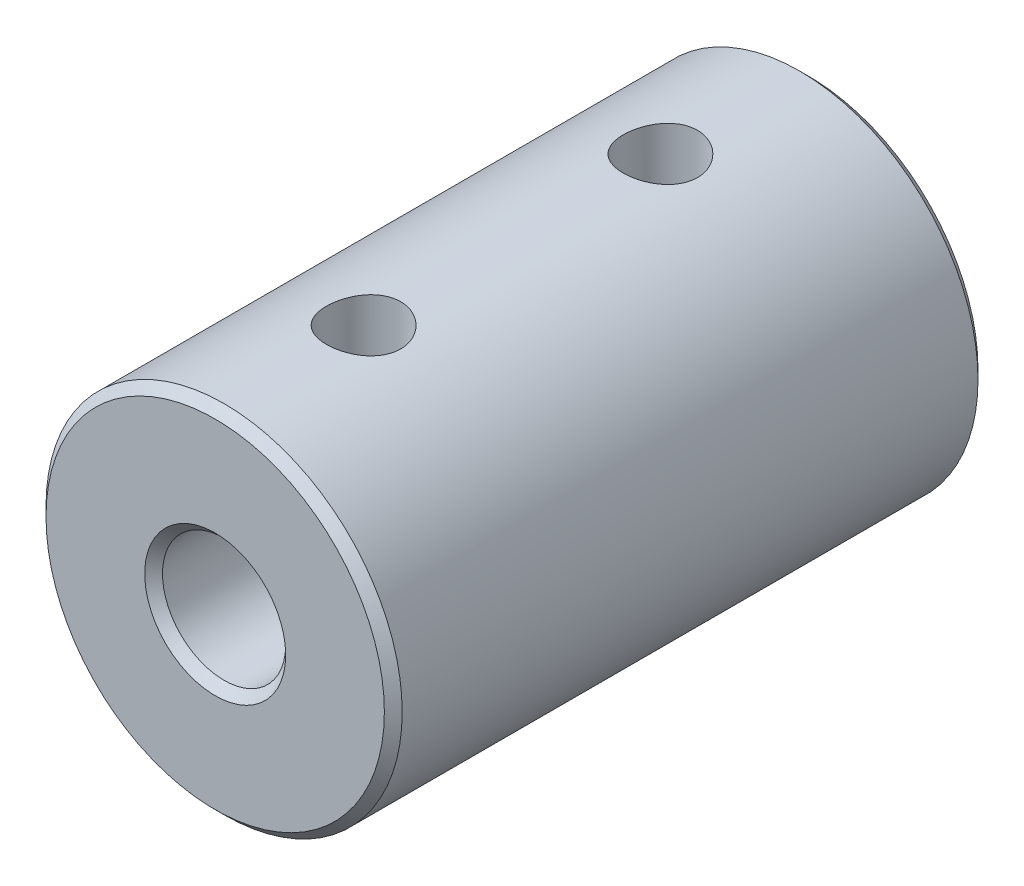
SolidWorks part; units mm, degrees
ref_plane "Plan de face" through (0, 0, 0) normal (0, 0, 1) x (1, 0, 0)
ref_plane "Plan de dessus" through (0, 0, 0) normal (0, 1, 0) x (1, 0, 0)
ref_plane "Plan de droite" through (0, 0, 0) normal (1, 0, 0) x (0, 0, -1)
sketch "Esquisse1" plane through (0, 0, 0) normal (0, 0, 1) x (1, 0, 0)
  circle A0 centre (0, 0) radius 6
  circle A1 centre (0, 0) radius 2.075
extrude "Boss.-Extru.1" add sketch "Esquisse1" along normal mid plane 20
ref_plane "Plan1" through (0, 0, 0) normal (0, 1, 0) x (-1, 0, 0)
sketch "Esquisse3" plane through (0, 0, 0) normal (0, 1, 0) x (-1, 0, 0)
  line L0 (0, -2.4446) -> (0, 9.3829) construction
  line L1 (-5.1223, 0) -> (1.4849, 0) construction
  line L2 (-5.1223, 5) -> (1.4849, 5) construction
  circle A0 centre (0, 5) radius 1.25
  circle A1 centre (0, -5) radius 1.25
  dimension "D1" = 5
extrude "Enlèv. mat.-Extru.2" cut sketch "Esquisse3" against normal mid plane 12
chamfer "Chanfrein1" distance 0.3 angle 45 4 edges at (2.075, 0, -10) (6, 0, -10) (6, 0, 10) (2.075, 0, 10)
